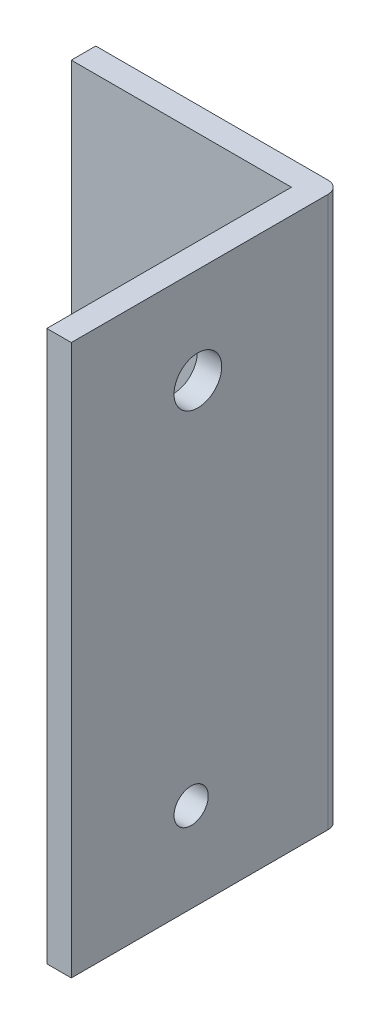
SolidWorks part; units mm, degrees
ref_plane "Front" through (0, 0, 0) normal (0, 0, 1) x (1, 0, 0)
ref_plane "Top" through (0, 0, 0) normal (0, 1, 0) x (1, 0, 0)
ref_plane "Right" through (0, 0, 0) normal (1, 0, 0) x (0, 0, -1)
sketch "Sketch1" plane through (0, 0, 0) normal (0, 0, 1) x (1, 0, 0)
  line L1 (-25.4, -57.15) -> (25.4, -57.15)
  line L2 (-25.4, -57.15) -> (-25.4, 57.15)
  line L3 (-25.4, 57.15) -> (25.4, 57.15)
  line L4 (25.4, -57.15) -> (25.4, 57.15)
  line L5 (-25.4, -57.15) -> (25.4, 57.15) construction
  line L6 (-25.4, 57.15) -> (25.4, -57.15) construction
  point P0 (0, 0)
  dimension "D1" = 50.8
  dimension "D2" = 114.3
extrude "Boss-Extrude1" add sketch "Sketch1" along normal blind 5.08
sketch "Sketch2" plane through (25.4, 0, 0) normal (1, 0, 0) x (0, 0, -1)
  line L0 (-5.08, 57.15) -> (-55.88, 57.15)
  line L1 (-55.88, 57.15) -> (-55.88, -57.15)
  line L2 (-55.88, -57.15) -> (-5.08, -57.15)
  line L3 (-5.08, -57.15) -> (-5.08, 57.15)
  dimension "D1" = 50.8
extrude "Boss-Extrude2" add sketch "Sketch2" against normal blind 5.08
fillet "Fillet1" radius 2.54 1 edges at (25.4, 0, 0)
sketch "Sketch3" plane through (20.32, 0, 0) normal (-1, 0, 0) x (0, 0, 1)
  circle A0 centre (29.591, 37.211) radius 4.953
  circle A1 centre (30.988, -38.608) radius 3.556
  dimension "D1" = 7.112
  dimension "D2" = 9.906
extrude "Cut-Extrude1" cut sketch "Sketch3" against normal through all
